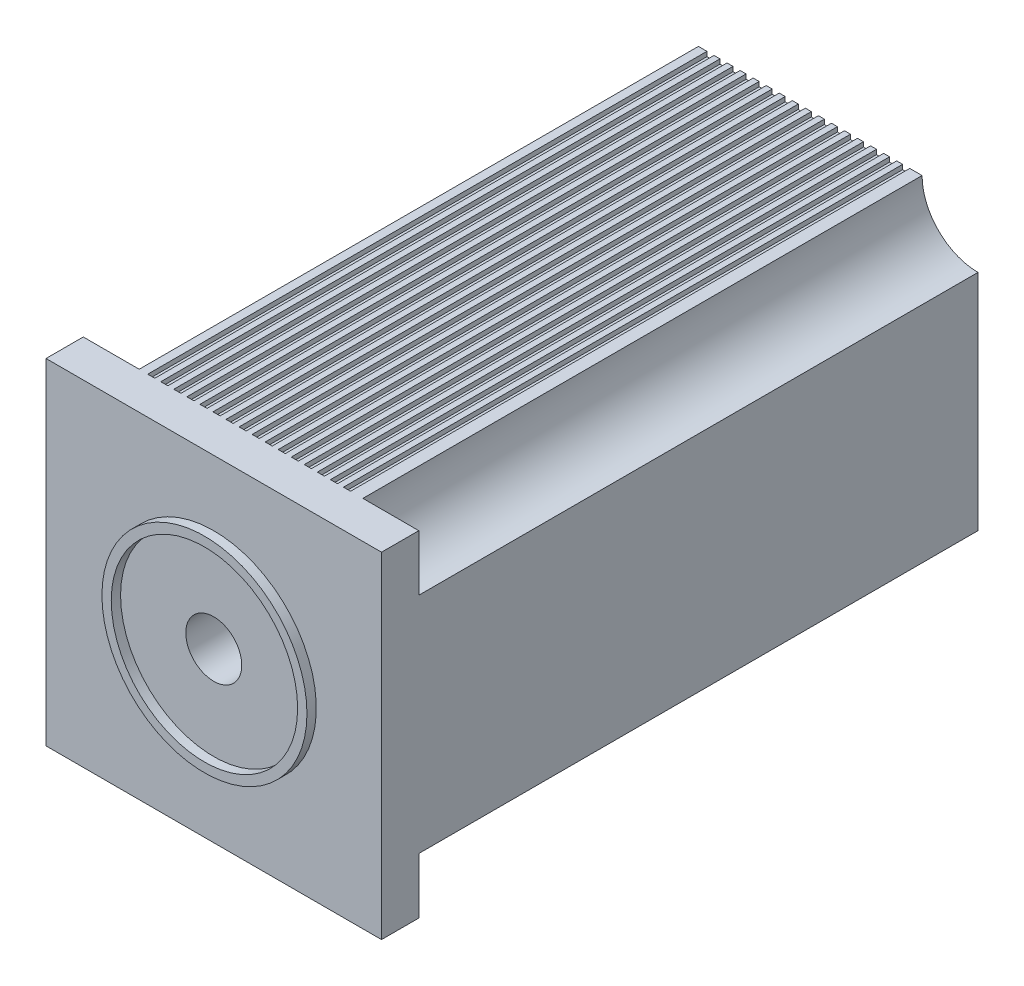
SolidWorks part; units mm, degrees
ref_plane "Front Plane" through (0, 0, 0) normal (0, 0, 1) x (1, 0, 0)
ref_plane "Top Plane" through (0, 0, 0) normal (0, 1, 0) x (1, 0, 0)
ref_plane "Right Plane" through (0, 0, 0) normal (1, 0, 0) x (0, 0, -1)
sketch "Sketch1" plane through (0, 0, 0) normal (0, 0, 1) x (1, 0, 0)
  line L1 (-90, -90) -> (90, -90)
  line L2 (-90, -90) -> (-90, 90)
  line L3 (-90, 90) -> (90, 90)
  line L4 (90, -90) -> (90, 90)
  dimension "D1" = 90
  dimension "D2" = 180
  dimension "D3" = 90
  dimension "D4" = 180
extrude "Boss-Extrude1" add sketch "Sketch1" along normal blind 20 and the other way blind 300
sketch "Sketch2" plane through (0, 0, 0) normal (0, 0, 1) x (1, 0, 0)
  circle A0 centre (90, 90) radius 30
  circle A1 centre (-90, 90) radius 30
  circle A2 centre (-90, -90) radius 30
  circle A3 centre (90, -90) radius 30
extrude "Cut-Extrude1" cut sketch "Sketch2" against normal blind 371
sketch "Sketch3" plane through (0, 0, 0) normal (0, 0, 1) x (1, 0, 0)
  line L1 (-55.416, 91.9383) -> (-51.6212, 91.9383)
  line L2 (-55.416, 91.9383) -> (-55.416, 87.511)
  line L3 (-55.416, 87.511) -> (-51.6212, 87.511)
  line L4 (-51.6212, 91.9383) -> (-51.6212, 87.511)
extrude "Cut-Extrude2" cut sketch "Sketch3" against normal blind 351
pattern_linear "LPattern1" count 16 spacing 7 along (1, 0, 0) of "Cut-Extrude2"
sketch "Sketch4" plane through (0, 0, 0) normal (0, 0, 1) x (1, 0, 0)
  line L1 (-57.9297, -91.9887) -> (-54.6857, -91.9887)
  line L2 (-57.9297, -91.9887) -> (-57.9297, -88.7446)
  line L3 (-57.9297, -88.7446) -> (-54.6857, -88.7446)
  line L4 (-54.6857, -91.9887) -> (-54.6857, -88.7446)
extrude "Cut-Extrude3" cut sketch "Sketch4" against normal blind 477
pattern_linear "LPattern2" count 17 spacing 7 along (1, 0, 0) of "Cut-Extrude3"
sketch "Sketch5" plane through (0, 0, 0) normal (0, 0, 1) x (1, 0, 0)
  circle A0 centre (0, 0) radius 50
  circle A1 centre (0, 0) radius 55
extrude "Boss-Extrude2" add sketch "Sketch5" along normal blind 25
sketch "Sketch6" plane through (0, 0, 0) normal (0, 0, 1) x (1, 0, 0)
  circle A0 centre (0, 0) radius 15
extrude "Cut-Extrude4" cut sketch "Sketch6" along normal blind 87 and the other way blind 400
sketch "Sketch7" plane through (0, 0, 0) normal (1, 0, 0) x (0, 0, -1)
  line L0 (300, 64.4365) -> (305.2683, 64.4365)
  line L1 (300, 60) -> (300, 90) construction
  line L2 (305.2683, 64.4365) -> (305.2683, 67.3494)
  line L3 (305.2683, 67.3494) -> (312.6138, 67.3494)
  line L4 (312.6138, 67.3494) -> (317.4264, 65.893)
  line L5 (317.4264, 65.893) -> (315.4353, 64.827)
  line L6 (315.4353, 64.827) -> (315.4353, 63.2967)
  line L7 (315.4353, 63.2967) -> (300, 63.2967)
  line L8 (300, 63.2967) -> (300, 64.4365)
revolve "Revolve3" add sketch "Sketch7" angle 360 about L7
